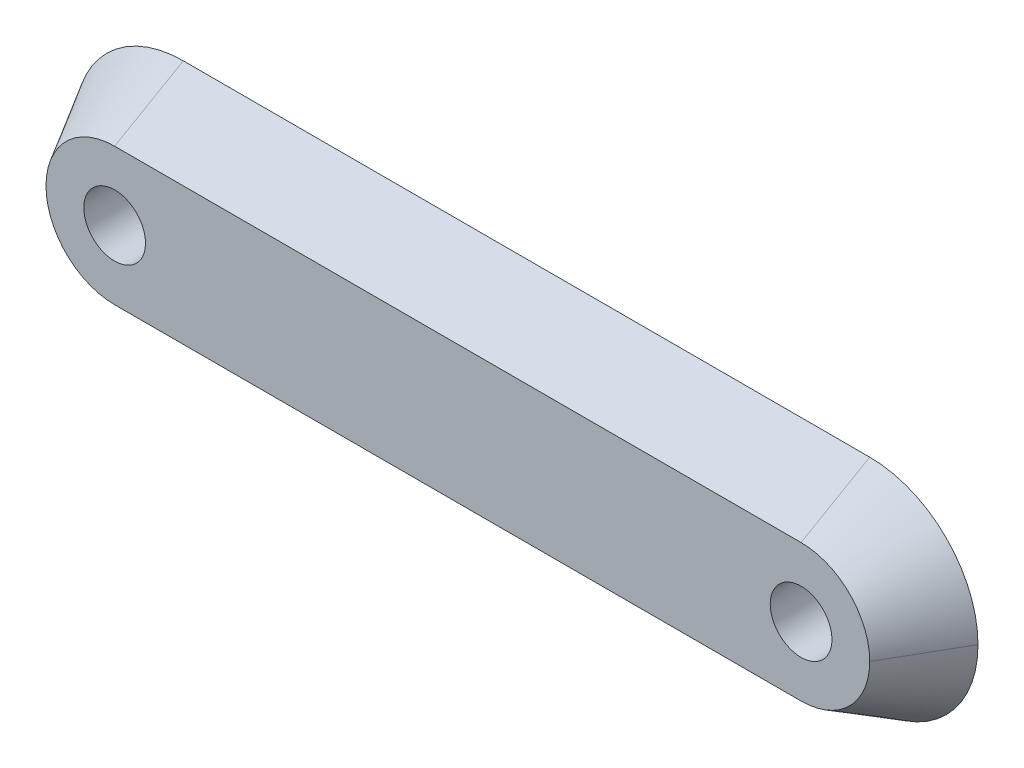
SolidWorks part; units mm, degrees
ref_plane "Front" through (0, 0, 0) normal (0, 0, 1) x (1, 0, 0)
ref_plane "Top" through (0, 0, 0) normal (0, 1, 0) x (1, 0, 0)
ref_plane "Right" through (0, 0, 0) normal (1, 0, 0) x (0, 0, -1)
sketch "Sketch1" plane through (0, 0, 0) normal (0, 0, 1) x (1, 0, 0)
  line L1 (30, -5) -> (-30, -5)
  line L2 (30, -5) -> (30, 5)
  line L3 (30, 5) -> (-30, 5)
  line L4 (-30, -5) -> (-30, 5)
  line L5 (30, -5) -> (-30, 5) construction
  line L6 (30, 5) -> (-30, -5) construction
  point P0 (0, 0)
  dimension "D1" = 10
  dimension "D2" = 60
extrude "Extrude1" add sketch "Sketch1" along normal blind 5
fillet "Fillet1" radius 5 4 edges at (-30, -5, 2.5) (-30, 5, 2.5) (30, 5, 2.5) (30, -5, 2.5)
draft "Draft1" type of draft neutral plane draft angle 30 faces to draft 6 parameters "D1"=30
hole_wizard "CSK for #8 Flat Head Machine Screw (100)1" positions "Sketch3" profile "Sketch2" countersink size "#8" standard "ANSI Inch"
sketch "Sketch3" plane through (0, 0, 0) normal (0, 0, -1) x (-1, 0, 0)
  line L0 (25, 0) -> (0, 0) construction
  line L1 (0, 0) -> (0, 24.3925) construction
  point P0 (25, 0)
  point P14 (-25, 0)
  dimension "D1" = 50
sketch "Sketch2" plane through (-25, 0, 0) normal (1, 0, 0) x (0, 1, 0)
  line L0 (0, 0) -> (0, 5)
  line L1 (0, 5) -> (2.2479, 5)
  line L2 (2.2479, 5) -> (2.2479, 1.6518)
  line L3 (2.2479, 1.6518) -> (4.2164, 0)
  line L5 (4.2164, 0) -> (0, 0)
  line L6 (-2.2479, 1.6518) -> (-4.2164, 0) construction
  line L11 (0, -6.35) -> (0, 107.95) construction
  dimension "Thru Hole Dia." = 4.4958
  dimension "Thru Hole Depth" = 5
  dimension "Near C'Sink Dia." = 8.4328
  dimension "Near C'Sink Angle" = 100
